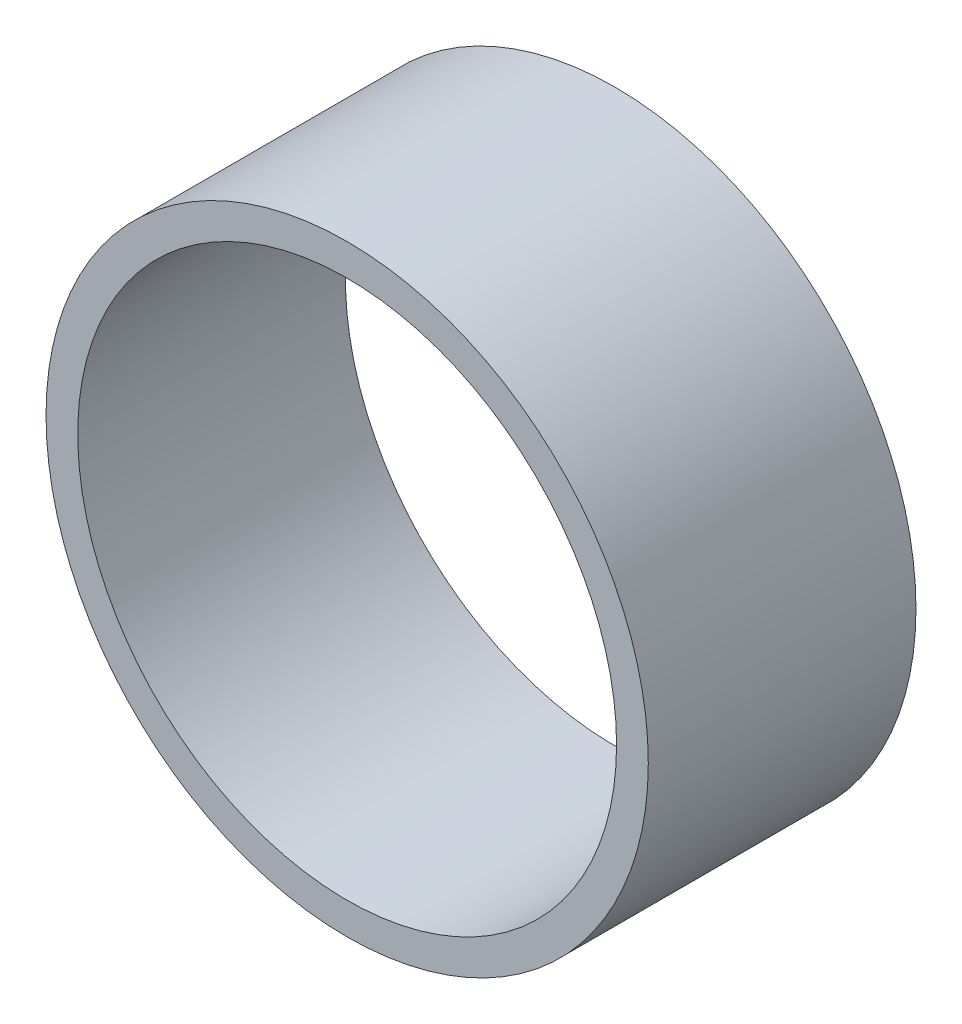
SolidWorks part; units mm, degrees
ref_plane "Front" through (0, 0, 0) normal (0, 0, 1) x (1, 0, 0)
ref_plane "Top" through (0, 0, 0) normal (0, 1, 0) x (1, 0, 0)
ref_plane "Side" through (0, 0, 0) normal (1, 0, 0) x (0, 0, -1)
sketch "PipeSketch"
  dimension "OuterDiameter" = 114.3
  dimension "InnerDiameter" = 102.2604
extrude "Extrusion" add sketch "PipeSketch" along normal blind 50.8
sketch "FilterSketch" plane through (0, 0, 0) normal (0, 0, 1) x (1, 0, 0)
  circle A0 centre (0, 0) radius 50.8 construction
  dimension "NominalDiameter" = 101.6
